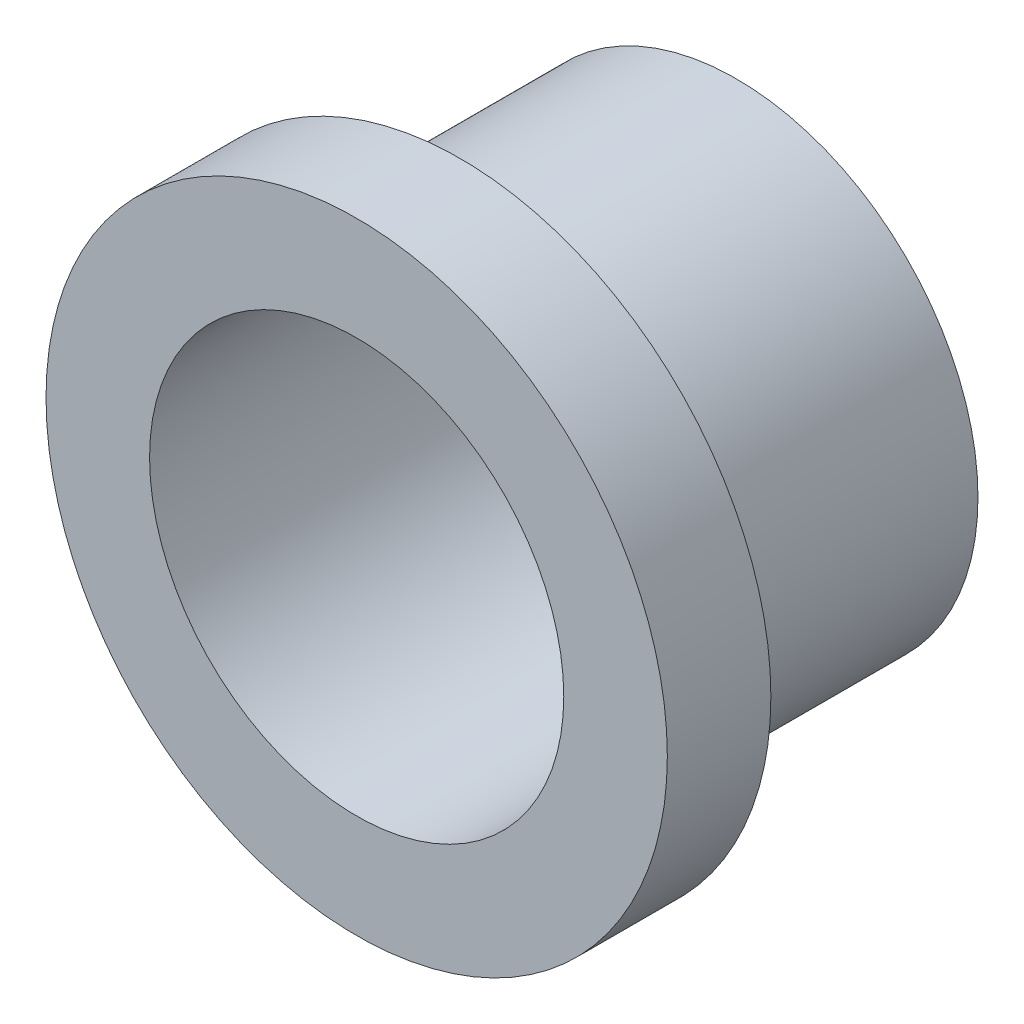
SolidWorks part; units mm, degrees
ref_plane "Ön Düzlem" through (0, 0, 0) normal (0, 0, 1) x (1, 0, 0)
ref_plane "Üst Düzlem" through (0, 0, 0) normal (0, 1, 0) x (1, 0, 0)
ref_plane "Sağ Düzlem" through (0, 0, 0) normal (1, 0, 0) x (0, 0, -1)
sketch "Sketch2" plane through (0, 0, 0) normal (0, 0, 1) x (1, 0, 0)
  circle A0 centre (0, 0) radius 7
  dimension "D1" = 14
extrude "Boss-Extrude1" add sketch "Sketch2" along normal blind 8
sketch "Sketch3" plane through (0, 0, 8) normal (0, 0, 1) x (1, 0, 0)
  circle A0 centre (0, 0) radius 9
  dimension "D1" = 18
extrude "Boss-Extrude2" add sketch "Sketch3" along normal blind 3
hole_wizard "Ø12.0mm Dowel Hole1" positions "Sketch4" profile "Sketch5" hole size "Ø12.0" standard "ISO"
sketch "Sketch4" plane through (0, 0, 11) normal (0, 0, 1) x (1, 0, 0)
  point P0 (0, 0)
sketch "Sketch5" plane through (0, 0, 11) normal (1, 0, 0) x (0, -1, 0)
  line L0 (0, 0) -> (0, 17.6052)
  line L1 (0, 17.6052) -> (6, 14)
  line L2 (6, 14) -> (6, 0)
  line L5 (6, 0) -> (0, 0)
  line L10 (0, 17.6052) -> (-6, 14) construction
  line L11 (0, -6.35) -> (0, 107.95) construction
  dimension "Hole Dia." = 12
  dimension "Hole Depth" = 14
  dimension "Drill Angle" = 118
